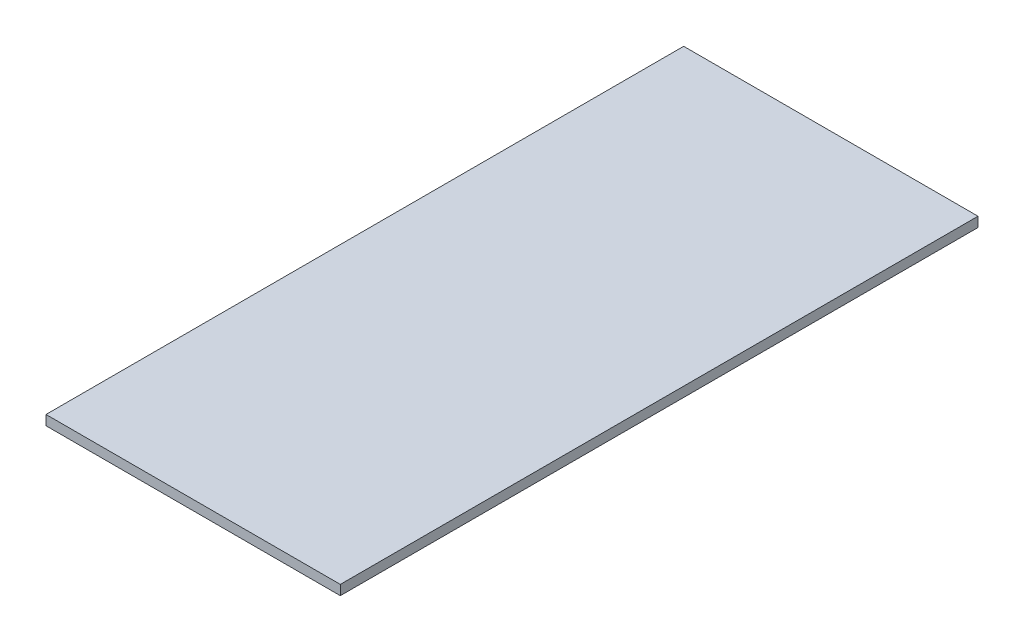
SolidWorks part; units mm, degrees
ref_plane "Front Plane" through (0, 0, 0) normal (0, 0, 1) x (1, 0, 0)
ref_plane "Top Plane" through (0, 0, 0) normal (0, 1, 0) x (1, 0, 0)
ref_plane "Right Plane" through (0, 0, 0) normal (1, 0, 0) x (0, 0, -1)
sketch "Sketch1" plane through (0, 0, 0) normal (0, 1, 0) x (1, 0, 0)
  line L1 (0, 0) -> (30, 0)
  line L2 (0, 0) -> (0, 65)
  line L3 (0, 65) -> (30, 65)
  line L4 (30, 0) -> (30, 65)
  dimension "D1" = 30
  dimension "D2" = 65
extrude "Boss-Extrude1" add sketch "Sketch1" along normal blind 1
